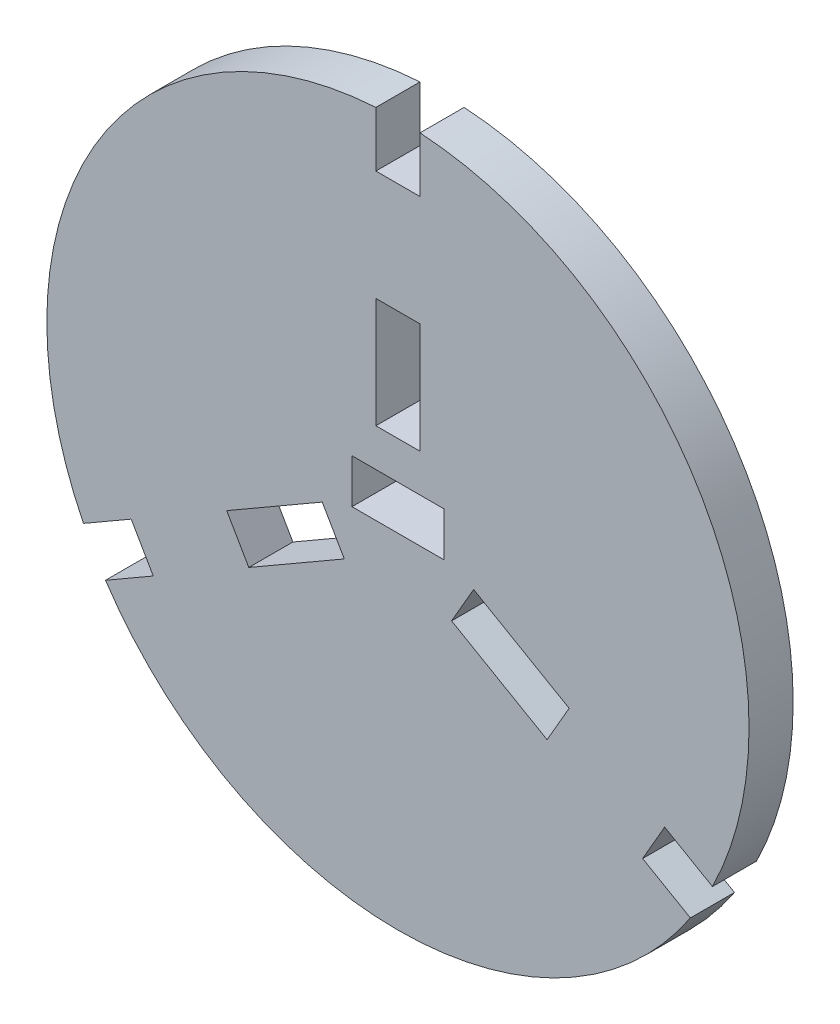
SolidWorks part; units mm, degrees
ref_plane "Alzado" through (0, 0, 0) normal (0, 0, 1) x (1, 0, 0)
ref_plane "Planta" through (0, 0, 0) normal (0, 1, 0) x (1, 0, 0)
ref_plane "Vista lateral" through (0, 0, 0) normal (1, 0, 0) x (0, 0, -1)
sketch "Sketch1" plane through (0, 0, 0) normal (0, 0, 1) x (1, 0, 0)
  line L0 (85.542, -42.4595) -> (72.5517, -34.9595)
  line L2 (-6, 95.3113) -> (-6, 80.3113)
  line L3 (-6, 80.3113) -> (6, 80.3113)
  line L4 (6, 95.3113) -> (6, 80.3113)
  line L5 (-6, 95.3113) -> (6, 80.3113) construction
  line L6 (-6, 80.3113) -> (6, 95.3113) construction
  line L7 (-6, 50.3113) -> (6, 50.3113)
  line L8 (-6, 50.3113) -> (-6, 20.3113)
  line L9 (-6, 20.3113) -> (6, 20.3113)
  line L10 (6, 50.3113) -> (6, 20.3113)
  line L11 (-6, 50.3113) -> (6, 20.3113) construction
  line L12 (-6, 20.3113) -> (6, 50.3113) construction
  line L13 (72.5517, -34.9595) -> (66.5517, -45.3518)
  line L14 (79.542, -52.8518) -> (66.5517, -45.3518)
  line L15 (46.5709, -19.9595) -> (40.5709, -30.3518)
  line L16 (46.5709, -19.9595) -> (20.5901, -4.9595)
  line L17 (20.5901, -4.9595) -> (14.5901, -15.3518)
  line L18 (40.5709, -30.3518) -> (14.5901, -15.3518)
  line L19 (85.542, -42.4595) -> (66.5517, -45.3518) construction
  line L20 (72.5517, -34.9595) -> (79.542, -52.8518) construction
  line L21 (46.5709, -19.9595) -> (14.5901, -15.3518) construction
  line L22 (20.5901, -4.9595) -> (40.5709, -30.3518) construction
  line L23 (-79.542, -52.8518) -> (-66.5517, -45.3518)
  line L24 (-66.5517, -45.3518) -> (-72.5517, -34.9595)
  line L25 (-85.542, -42.4595) -> (-72.5517, -34.9595)
  line L26 (-40.5709, -30.3518) -> (-46.5709, -19.9595)
  line L27 (-40.5709, -30.3518) -> (-14.5901, -15.3518)
  line L28 (-14.5901, -15.3518) -> (-20.5901, -4.9595)
  line L29 (-46.5709, -19.9595) -> (-20.5901, -4.9595)
  line L30 (-76.0468, -43.9057) -> (-72.5517, -34.9595) construction
  line L31 (-66.5517, -45.3518) -> (-85.542, -42.4595) construction
  line L32 (-40.5709, -30.3518) -> (-20.5901, -4.9595) construction
  line L33 (-14.5901, -15.3518) -> (-46.5709, -19.9595) construction
  arc A0 (-6, 95.3113) -> (-85.542, -42.4595) centre (0, 0) ccw
  arc A1 (85.542, -42.4595) -> (6, 95.3113) centre (0, 0) ccw
  arc A2 (-79.542, -52.8518) -> (79.542, -52.8518) centre (0, 0) ccw
  point P7 (0, 87.8113)
  point P12 (0, 35.3113)
  point P19 (76.0468, -43.9057)
  point P24 (30.5805, -17.6557)
  point P29 (-76.0468, -43.9057)
  point P34 (-30.5805, -17.6557)
  point P35 (0, 0)
  dimension "D1" = 191
  dimension "D2" = 15
  dimension "D3" = 12
  dimension "D4" = 12
  dimension "D5" = 30
  dimension "D6" = 30
  dimension "D7" = 3
extrude "Boss-Extrude1" add sketch "Sketch1" along normal blind 12
sketch "Sketch2" plane through (0, 0, 12) normal (0, 0, 1) x (1, 0, 0)
  line L5 (-12.5, 10) -> (12.5, 10)
  line L6 (-12.5, 10) -> (-12.5, -2)
  line L7 (-12.5, -2) -> (12.5, -2)
  line L8 (12.5, 10) -> (12.5, -2)
  line L9 (-12.5, 10) -> (12.5, -2) construction
  line L10 (-12.5, -2) -> (12.5, 10) construction
  point P0 (0, 4)
  point P6 (0, 0)
  dimension "D1" = 12
  dimension "D2" = 25
  dimension "D3" = 2
extrude "Cut-Extrude1" cut sketch "Sketch2" against normal blind 20
